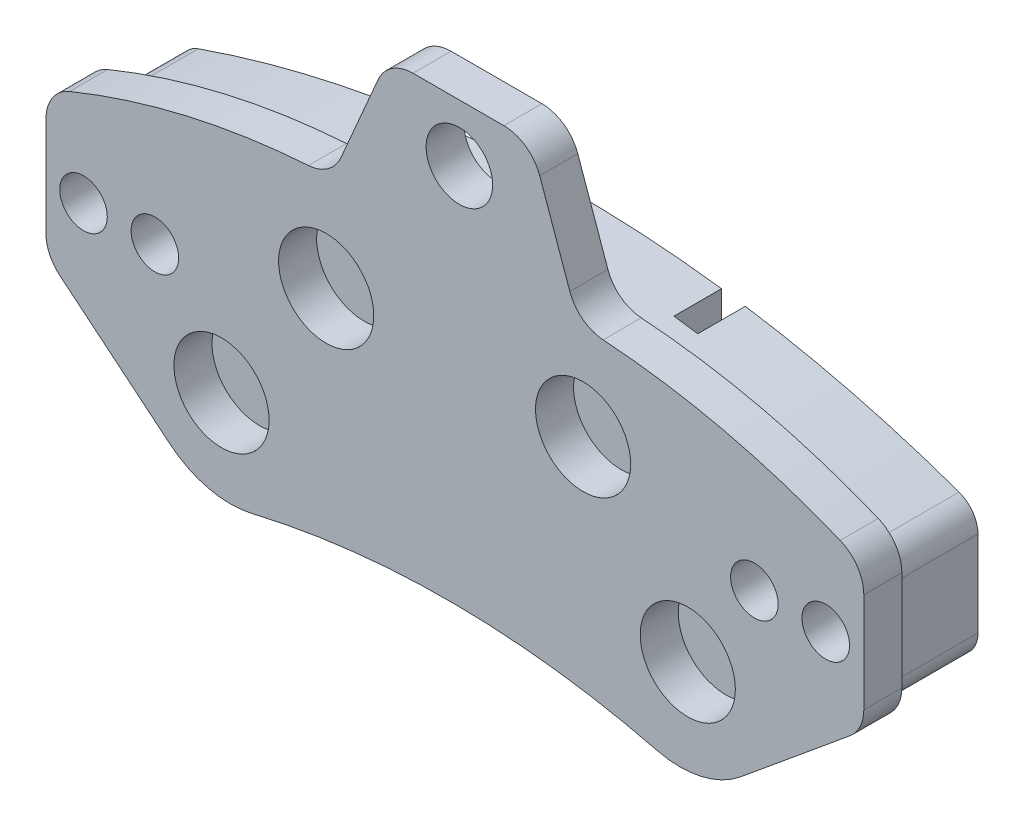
SolidWorks part; units mm, degrees
ref_plane "Face" through (0, 0, 0) normal (0, 0, 1) x (1, 0, 0)
ref_plane "Dessus" through (0, 0, 0) normal (0, 1, 0) x (1, 0, 0)
ref_plane "Droite" through (0, 0, 0) normal (1, 0, 0) x (0, 0, -1)
sketch "Esquisse1" plane through (0, 0, 0) normal (0, 0, 1) x (1, 0, 0)
  line L0 (-4.8691, 56) -> (4.6716, 56)
  line L1 (8.4428, 53.3333) -> (11.6083, 44.3801)
  line L2 (-8.542, 53.5843) -> (-12.4559, 44.5108)
  line L3 (42.5, 32.2243) -> (42.5, 21.7435)
  line L4 (41.0455, 18.6579) -> (29.5538, 9.1778)
  line L5 (-30.4279, 9.4913) -> (-41.9866, 19.0268)
  line L6 (-43.4411, 22.1123) -> (-43.4411, 32.5932)
  arc A0 (15.1072, 41.7227) -> (40.0178, 35.9252) centre (9.6618, -38.0918) cw
  arc A1 (20.763, 7.1907) -> (-21.766, 7.4729) centre (-1.0817, -80.118) ccw
  arc A2 (-40.9589, 36.2941) -> (-15.8656, 42.1038) centre (-10.6029, -37.7229) cw
  arc A3 (40.0178, 35.9252) -> (42.5, 32.2243) centre (38.5, 32.2243) cw
  arc A4 (11.6083, 44.3801) -> (15.1072, 41.7227) centre (15.3795, 45.7134) ccw
  arc A5 (4.6716, 56) -> (8.4428, 53.3333) centre (4.6716, 52) cw
  arc A6 (-4.8691, 56) -> (-8.542, 53.5843) centre (-4.8691, 52) ccw
  arc A7 (-12.4559, 44.5108) -> (-15.8656, 42.1038) centre (-16.1287, 46.0951) cw
  arc A8 (-43.4411, 32.5932) -> (-40.9589, 36.2941) centre (-39.4411, 32.5932) cw
  arc A9 (-41.9866, 19.0268) -> (-43.4411, 22.1123) centre (-39.4411, 22.1123) cw
  arc A10 (42.5, 21.7435) -> (41.0455, 18.6579) centre (38.5, 21.7435) cw
  arc A11 (29.5538, 9.1778) -> (20.763, 7.1907) centre (23.1902, 16.8917) cw
  arc A12 (-21.766, 7.4729) -> (-30.4279, 9.4913) centre (-24.0642, 17.2052) cw
  circle A13 centre (0, 50) radius 3.5
  circle A14 centre (38.5, 26.8579) radius 2.5
  circle A15 centre (31, 26.8579) radius 2.5
  circle A16 centre (-32, 26.8579) radius 2.5
  circle A17 centre (-39.5, 26.8579) radius 2.5
  circle A18 centre (-25, 16.8579) radius 5
  circle A19 centre (24, 16.8579) radius 5
  circle A20 centre (-14, 31.8579) radius 5
  circle A21 centre (13, 31.8579) radius 5
  point P15 (42.5, 34.8579)
  point P18 (12.5, 41.8579)
  point P21 (7.5, 56)
  point P24 (-7.5, 56)
  point P27 (-13.4411, 42.2267)
  point P30 (-43.4411, 35.2267)
  point P33 (-43.4411, 20.2267)
  point P36 (42.5, 19.8579)
  point P39 (25.5294, 5.8579)
  point P42 (-26.4706, 6.2267)
  dimension "D11" = 22
  dimension "D12" = 22
  dimension "D17" = 56
  dimension "D21" = 4
  dimension "D22" = 10
  dimension "D23" = 7
  dimension "D14" = 14
  dimension "D18" = 90
  dimension "D19" = 80
  dimension "D20" = 80
  dimension "D26" = 5
  dimension "D28" = 5
  dimension "D31" = 5
  dimension "D32" = 5
  dimension "D38" = 10
  dimension "D39" = 10
  dimension "D42" = 10
  dimension "D43" = 10
  dimension "D1" = 15
  dimension "D2" = 15
  dimension "D3" = 15
  dimension "D4" = 7.5
  dimension "D5" = 7
  dimension "D6" = 7
  dimension "D7" = 30
  dimension "D8" = 30
  dimension "D9" = 15
  dimension "D10" = 15
  dimension "D13" = 52
  dimension "D15" = 14
  dimension "D16" = 5
  dimension "D24" = 6
  dimension "D25" = 4
  dimension "D27" = 7
  dimension "D29" = 7.5
  dimension "D30" = 63
  dimension "D33" = 7.5
  dimension "D34" = 10
  dimension "D35" = 7
  dimension "D36" = 10
  dimension "D37" = 7
  dimension "D40" = 11
  dimension "D41" = 11
  dimension "D44" = 15
  dimension "D45" = 15
extrude "Extrusion1" add sketch "Esquisse1" against normal blind 4
sketch "Esquisse2" plane through (0, 0, -4) normal (0, 0, -1) x (-1, 0, 0)
  line L0 (42.4411, 31.1123) -> (42.4411, 22.1123)
  line L1 (41.3502, 19.7982) -> (30.3008, 10.6829)
  line L2 (-41.5, 30.7435) -> (-41.5, 21.7435)
  line L3 (-40.4091, 19.4293) -> (-29.427, 10.3695)
  line L4 (-42.5, 21.7435) -> (-42.5, 32.2243) construction
  line L5 (43.4411, 32.5932) -> (43.4411, 22.1123) construction
  line L8 (-29.5538, 9.1778) -> (-41.0455, 18.6579) construction
  line L9 (41.9866, 19.0268) -> (30.4279, 9.4913) construction
  arc A0 (21.6519, 8.6614) -> (30.3008, 10.6829) centre (23.9371, 18.3968) ccw
  arc A1 (-39.5126, 33.5674) -> (40.427, 33.9457) centre (0.9927, -79.3898) cw
  arc A2 (42.4411, 31.1123) -> (40.427, 33.9457) centre (39.4411, 31.1123) ccw
  arc A3 (-41.5, 30.7435) -> (-39.5126, 33.5674) centre (-38.5, 30.7435) cw
  arc A4 (-41.5, 21.7435) -> (-40.4091, 19.4293) centre (-38.5, 21.7435) ccw
  arc A5 (42.4411, 22.1123) -> (41.3502, 19.7982) centre (39.4411, 22.1123) cw
  arc A6 (-20.6485, 8.3794) -> (-29.427, 10.3695) centre (-23.0634, 18.0834) cw
  arc A18 (21.6519, 8.6614) -> (-20.6485, 8.3794) centre (1.0848, -78.9571) ccw
  point P29 (26.3502, 7.4238)
  point P32 (-25.4091, 7.0549)
  dimension "D1" = 3
  dimension "D2" = 15
  dimension "D5" = 9
  dimension "D6" = 120
  dimension "D7" = 1
  dimension "D9" = 90
  dimension "D10" = 10
  dimension "D3" = 15
  dimension "D4" = 9
  dimension "D8" = 1
  dimension "D12" = 1
  dimension "D13" = 1
extrude "Extrusion2" add sketch "Esquisse2" along normal blind 9
sketch "Esquisse3" plane through (0, 0, -13) normal (0, 0, -1) x (-1, 0, 0)
  line L0 (15.5519, 39.7238) -> (15.5519, 9.8725)
  line L1 (18.0519, 39.3915) -> (18.0519, 9.4291)
  line L5 (-17.0485, 9.1972) -> (-17.0485, 39.2463)
  line L6 (-14.5485, 9.6747) -> (-14.5485, 39.5996)
  arc A0 (40.427, 33.9457) -> (-39.5126, 33.5674) centre (0.9927, -79.3898) ccw construction
  arc A1 (21.6519, 8.6614) -> (-20.6485, 8.3794) centre (1.0848, -78.9571) ccw construction
  arc A2 (15.5519, 39.7238) -> (18.0519, 39.3915) centre (0.9927, -79.3898) cw
  arc A3 (-14.5485, 39.5996) -> (-17.0485, 39.2463) centre (0.9927, -79.3898) ccw
  arc A4 (18.0519, 9.4291) -> (15.5519, 9.8725) centre (1.0848, -78.9571) ccw
  arc A5 (-14.5485, 9.6747) -> (-17.0485, 9.1972) centre (1.0848, -78.9571) ccw
  dimension "D1" = 3.6
  dimension "D2" = 3.6
  dimension "D3" = 2.5
  dimension "D4" = 2.5
extrude "Enlèv. mat.-Extru.1" cut sketch "Esquisse3" against normal blind 5
